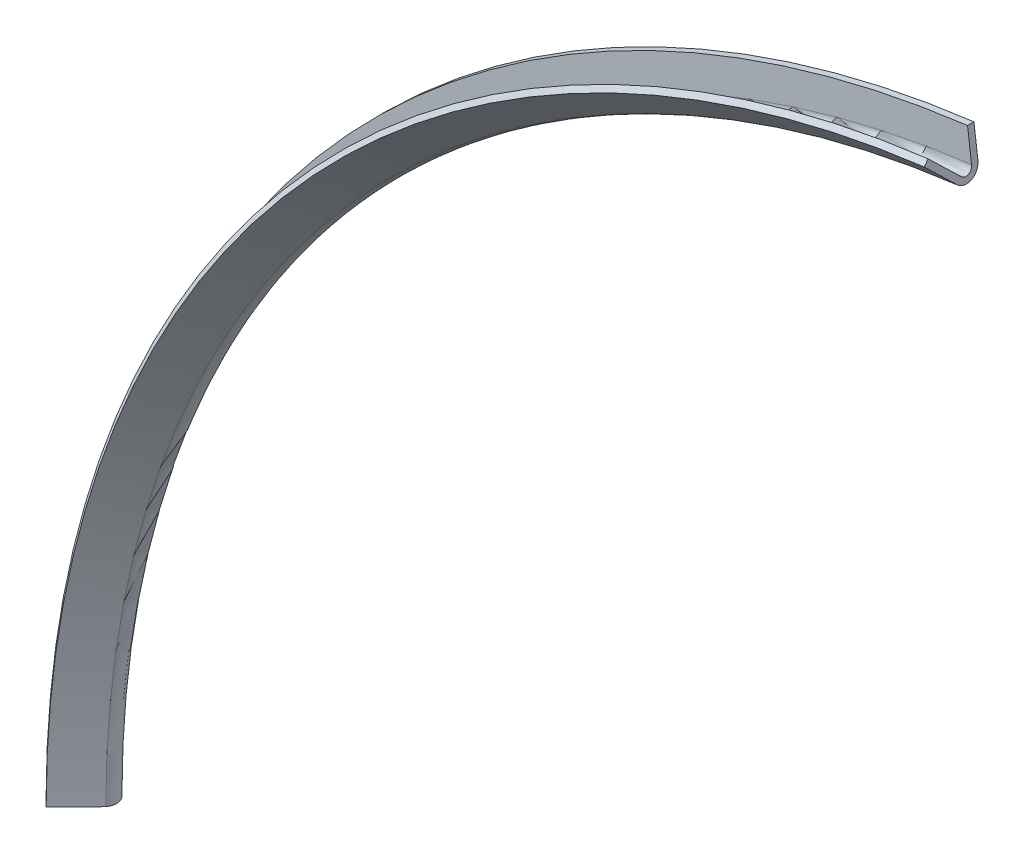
SolidWorks part; units mm, degrees
ref_plane "Спереди" through (0, 0, 0) normal (0, 0, 1) x (1, 0, 0)
ref_plane "Сверху" through (0, 0, 0) normal (0, 1, 0) x (1, 0, 0)
ref_plane "Справа" through (0, 0, 0) normal (1, 0, 0) x (0, 0, -1)
sketch "Эскиз1" plane through (0, 0, 0) normal (0, 0, 1) x (1, 0, 0)
  line L0 (-192.2324, 0) -> (207.9372, 0) construction
  arc A0 (-151, 0) -> (-18.5497, 149.8563) centre (0, 0) cw
  point P7 (-151, 0)
  point P8 (-18.5497, 149.8563)
  dimension "D1" = 151
  dimension "D2" = 200
sketch "Эскиз2" plane through (0, 0, 0) normal (0, 1, 0) x (1, 0, 0)
  line L0 (-158, -1) -> (-149.4078, -1) construction
  line L1 (-192.2324, 0) -> (207.9372, 0) construction
  line L2 (-151, 0) -> (-151, -0.316) construction
  line L3 (-158, -1) -> (-153, -1)
  line L4 (-151, -4.1149) -> (-151, 1.9595) construction
  line L5 (-158, 0) -> (-158, -1)
  line L6 (-156.0054, -8) -> (-151.4292, -3.2866)
  line L7 (-156.0054, -8) -> (-156.7229, -7.3034)
  line L8 (-156.7229, -7.3034) -> (-152.143, -2.5863)
  line L9 (-158, 0) -> (-153, 0)
  line L10 (-153, 0.5957) -> (-153, -3.1261) construction
  line L11 (-151, -2.0361) -> (-155.5508, -2.0361) construction
  arc A0 (-153, 0) -> (-151.4292, -3.2866) centre (-153.0364, -2.0361) cw
  arc A1 (-152.143, -2.5863) -> (-153, -1) centre (-152.9476, -1.9963) ccw
  point P6 (-158, -1)
  point P9 (-153, 0)
  point P11 (-156, 0)
  point P12 (-151, -1)
  point P13 (-156.0054, -8)
  point P16 (-151, 0)
  point P23 (-153, -2.0361)
  point P29 (-153, -1)
  dimension "D3" = 8
  dimension "D4" = 1
  dimension "D1" = 2
  dimension "D2" = 1
sweep "По траектории1" add profiles "Эскиз2" path "Эскиз1"
